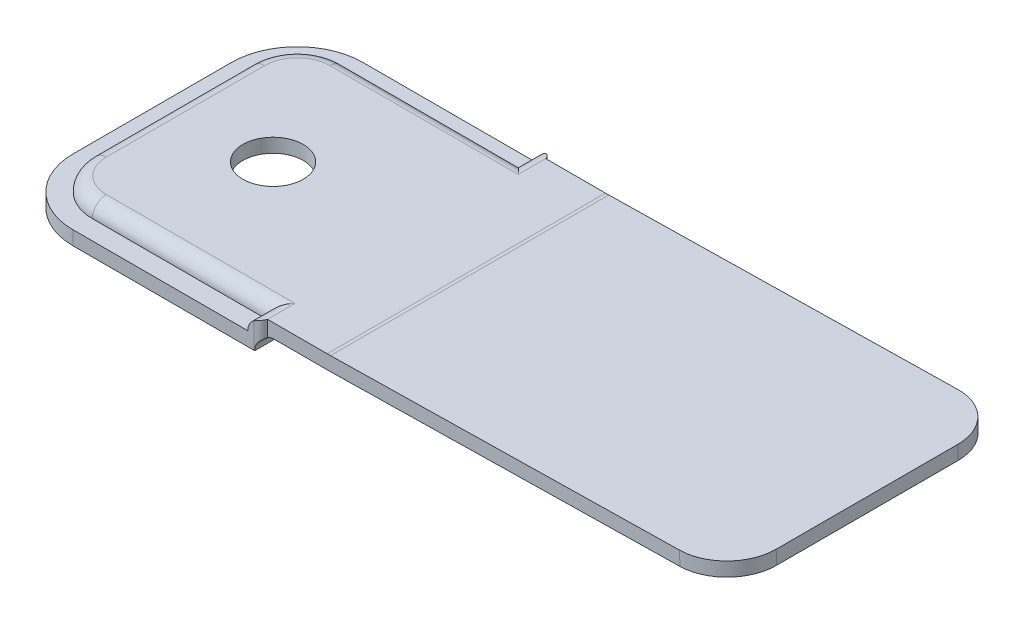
SolidWorks part; units mm, degrees
ref_plane "Спереди" through (0, 0, 0) normal (0, 0, 1) x (1, 0, 0)
ref_plane "Сверху" through (0, 0, 0) normal (0, 1, 0) x (1, 0, 0)
ref_plane "Справа" through (0, 0, 0) normal (1, 0, 0) x (0, 0, -1)
sketch "Эскиз1" plane through (0, 0, 0) normal (0, 1, 0) x (1, 0, 0)
  line L0 (-11.044, 0) -> (71.7325, 0) construction
  line L2 (8.3185, 9.525) -> (-3.6195, 9.525)
  line L3 (8.3185, 9.525) -> (8.3185, -9.525)
  line L4 (8.3185, -9.525) -> (-3.6195, -9.525)
  line L5 (-7.9375, 5.207) -> (-7.9375, -5.207)
  circle A0 centre (0, 0) radius 1.9844
  arc A1 (-3.6195, -9.525) -> (-7.9375, -5.207) centre (-3.6195, -5.207) cw
  arc A2 (-3.6195, 9.525) -> (-7.9375, 5.207) centre (-3.6195, 5.207) ccw
  dimension "D2" = 3.9688
  dimension "D5" = 4.318
  dimension "D1" = 19.05
  dimension "D3" = 7.9375
  dimension "D4" = 16.256
extrude "Бобышка-Вытянуть1" add sketch "Эскиз1" along normal blind 0.9144
sketch "Эскиз2" plane through (0, 0.9144, 0) normal (0, 1, 0) x (1, 0, 0)
  line L0 (8.3185, -9.525) -> (8.3185, 9.525) construction
  line L1 (8.3185, -8.255) -> (-3.6195, -8.255)
  line L2 (8.3185, -8.255) -> (8.3185, 8.255)
  line L3 (8.3185, 8.255) -> (-3.6195, 8.255)
  line L4 (-6.6675, -5.207) -> (-6.6675, 5.207)
  line L5 (8.3185, 9.525) -> (-3.6195, 9.525) construction
  line L6 (-3.6195, -9.525) -> (8.3185, -9.525) construction
  line L8 (-7.9375, 5.207) -> (-7.9375, -5.207) construction
  arc A0 (-6.6675, 5.207) -> (-3.6195, 8.255) centre (-3.6195, 5.207) cw
  arc A1 (-3.6195, -8.255) -> (-6.6675, -5.207) centre (-3.6195, -5.207) cw
  arc A2 (-7.9375, -5.207) -> (-3.6195, -9.525) centre (-3.6195, -5.207) ccw construction
  arc A3 (-3.6195, 9.525) -> (-7.9375, 5.207) centre (-3.6195, 5.207) ccw construction
  circle A4 centre (0, 0) radius 1.9844
  circle A5 centre (0, 0) radius 1.9844 construction
  point P8 (2.3495, -9.525)
  dimension "D1" = 1.27
  dimension "D2" = 1.27
  dimension "D3" = 1.27
extrude "Бобышка-Вытянуть2" add sketch "Эскиз2" along normal blind 0.9144
sketch "Эскиз3" plane through (0, 0, 0) normal (0, -1, 0) x (1, 0, 0)
  line L0 (-3.6195, 7.3406) -> (8.3185, 7.3406)
  line L1 (8.3185, 9.525) -> (8.3185, -9.525) construction
  line L2 (8.3185, 7.3406) -> (8.3185, -7.3406)
  line L3 (8.3185, -7.3406) -> (-3.6195, -7.3406)
  line L4 (-3.6195, 8.255) -> (8.3185, 8.255) construction
  line L5 (-5.7531, -5.207) -> (-5.7531, 5.207)
  line L6 (8.3185, -8.255) -> (-3.6195, -8.255) construction
  arc A0 (-5.7531, 5.207) -> (-3.6195, 7.3406) centre (-3.6195, 5.207) cw
  arc A1 (-5.7531, -5.207) -> (-3.6195, -7.3406) centre (-3.6195, -5.207) ccw
  arc A2 (-3.6195, 9.525) -> (-7.9375, 5.207) centre (-3.6195, 5.207) ccw construction
  arc A3 (-7.9375, -5.207) -> (-3.6195, -9.525) centre (-3.6195, -5.207) ccw construction
  dimension "D1" = 0.9144
  dimension "D2" = 0.9144
extrude "Вырез-Вытянуть1" cut sketch "Эскиз3" against normal blind 0.9144
sketch "Эскиз6" plane through (0, 0.9144, 0) normal (0, 1, 0) x (1, 0, 0)
  line L0 (8.3185, 9.525) -> (-3.6195, 9.525) construction
  line L1 (7.8613, 9.525) -> (8.7757, 9.525)
  line L2 (7.8613, 9.525) -> (7.8613, -9.525)
  line L3 (7.8613, -9.525) -> (8.7757, -9.525)
  line L4 (8.7757, 9.525) -> (8.7757, -9.525)
  line L5 (-3.6195, -9.525) -> (8.3185, -9.525) construction
  line L6 (8.3185, -9.525) -> (8.3185, -8.255) construction
  dimension "D1" = 0.4572
  dimension "D2" = 0.4572
extrude "Бобышка-Вытянуть4" add sketch "Эскиз6" along normal blind 0.9144
sketch "Эскиз4" plane through (0, 0, 0) normal (0, 0, -1) x (-1, 0, 0)
  line L0 (-12.7, 1.8288) -> (-8.3185, 1.8288)
  line L1 (-12.9373, 0.9165) -> (-39.0525, 1.3717)
  line L2 (-39.0525, 1.3717) -> (-39.0366, 2.286)
  line L3 (-39.0366, 2.286) -> (-12.9214, 1.8307)
  line L6 (-8.3185, 0) -> (3.6195, 0) construction
  line L7 (-8.3185, 1.8288) -> (-8.3185, 0.9144)
  line L8 (-8.3185, 0.9144) -> (-12.7, 0.9144)
  line L9 (-7.8613, 1.8288) -> (3.6195, 1.8288) construction
  line L10 (-7.8613, 0.9144) -> (3.6195, 0.9144) construction
  line L11 (7.9375, 0.9144) -> (7.9375, 0) construction
  line L12 (-8.3185, 0.9144) -> (-8.3185, 0) construction
  arc A0 (-12.7, 1.8288) -> (-12.9214, 1.8307) centre (-12.7, 14.5288) cw
  arc A1 (-12.7, 0.9144) -> (-12.9373, 0.9165) centre (-12.7, 14.5288) cw
  dimension "D2" = 12.7
  dimension "D1" = 2.286
  dimension "D3" = 20.6375
  dimension "D4" = 46.99
extrude "Бобышка-Вытянуть3" add sketch "Эскиз4" against normal mid plane 18.288
fillet "Скругление1" radius 0.9144 14 edges at (2.1209, 1.8288, 8.255) (-5.7748, 1.8288, 7.3623) (-6.6675, 1.8288, 0) (-5.7748, 1.8288, -7.3623) (2.3495, 0.9144, -7.3406) (-5.1282, 0.9144, -6.7157) (-5.7531, 0.9144, 0) (-5.1282, 0.9144, 6.7157) (7.8613, 1.8288, 8.89) (2.1209, 1.8288, -8.255) (7.8613, 1.8288, -8.89) (2.3495, 0.9144, 7.3406)
fillet "Скругление2" radius 0.508 2 edges at (8.7757, 1.3103, 9.525) (8.7757, 1.3103, -9.525)
fillet "Скругление3" radius 3.175 2 edges at (39.0445, 1.8289, 9.144) (39.0445, 1.8289, -9.144)
